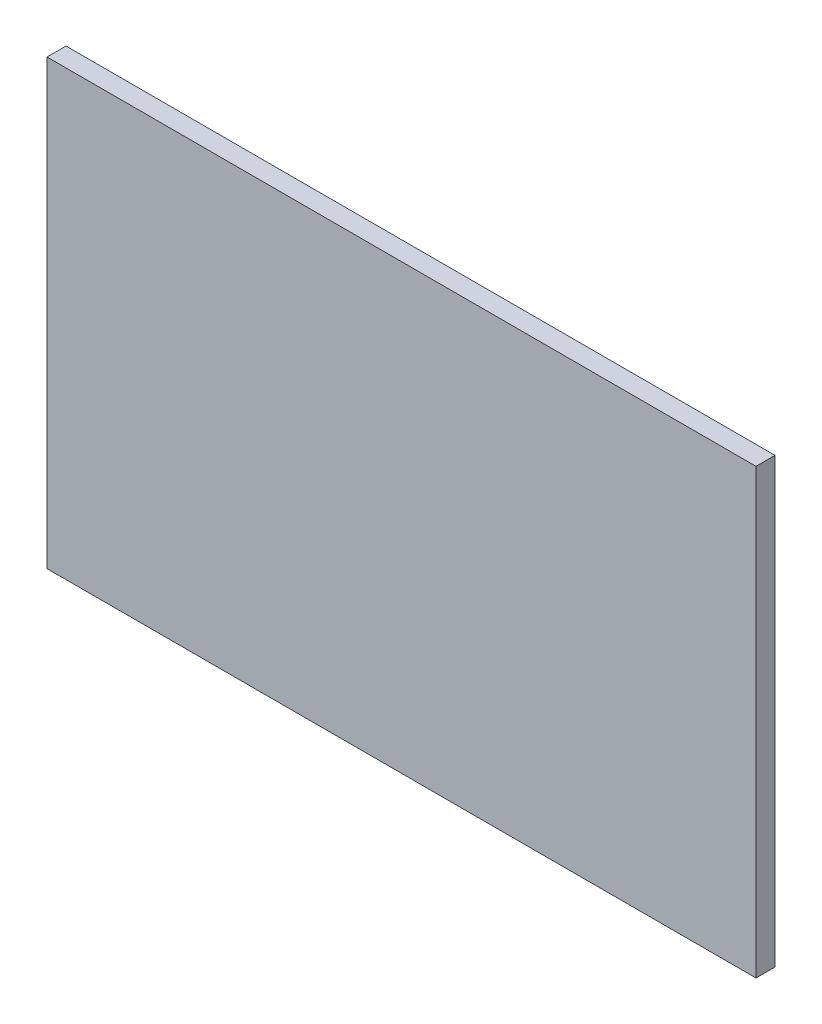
SolidWorks part; units mm, degrees
ref_plane "Face" through (0, 0, 0) normal (0, 0, 1) x (1, 0, 0)
ref_plane "Dessus" through (0, 0, 0) normal (0, 1, 0) x (1, 0, 0)
ref_plane "Droite" through (0, 0, 0) normal (1, 0, 0) x (0, 0, -1)
sketch "Esquisse1" plane through (0, 0, 0) normal (0, 0, 1) x (1, 0, 0)
  line L1 (0, 35) -> (56, 35)
  line L2 (0, 35) -> (0, 0)
  line L3 (0, 0) -> (56, 0)
  line L4 (56, 35) -> (56, 0)
  dimension "D1" = 56
  dimension "D2" = 35
extrude "Base-Extrusion" add sketch "Esquisse1" along normal blind 1.5
sketch "Esquisse4"
sketch "Esquisse6"
